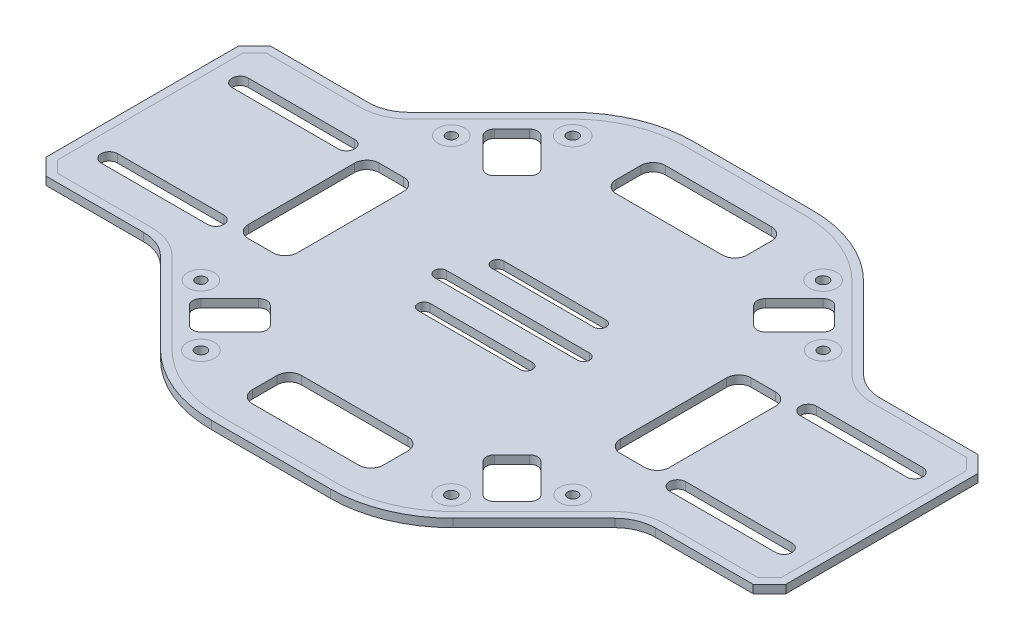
SolidWorks part; units mm, degrees
ref_plane "XY" through (0, 0, 0) normal (0, 0, 1) x (1, 0, 0)
ref_plane "XZ" through (0, 0, 0) normal (0, 1, 0) x (1, 0, 0)
ref_plane "YZ" through (0, 0, 0) normal (1, 0, 0) x (0, 0, -1)
sketch "Esquisse1" plane through (0, 0, 0) normal (0, 1, 0) x (1, 0, 0)
  line L1 (-14.5736, 59) -> (14.5736, 59)
  line L2 (-90.5, 23.5) -> (-90.5, -23.5)
  line L3 (-14.5736, -59) -> (14.5736, -59)
  line L4 (-55.5711, -30.4289) -> (-35.7868, -50.2132)
  line L5 (-90.5, 23.5) -> (-86.5, 27.5)
  line L6 (169.9288, 0) -> (-169.9288, 0) construction
  line L7 (-86.5, 27.5) -> (-62.6421, 27.5)
  line L8 (-55.5711, 30.4289) -> (-35.7868, 50.2132)
  line L9 (0, 72.9784) -> (0, -72.9784) construction
  line L10 (-86.5, -27.5) -> (-62.6421, -27.5)
  line L11 (-90.5, -23.5) -> (-86.5, -27.5)
  line L12 (90.5, -23.5) -> (86.5, -27.5)
  line L13 (86.5, -27.5) -> (62.6421, -27.5)
  line L14 (55.5711, 30.4289) -> (35.7868, 50.2132)
  line L15 (86.5, 27.5) -> (62.6421, 27.5)
  line L16 (90.5, 23.5) -> (86.5, 27.5)
  line L17 (55.5711, -30.4289) -> (35.7868, -50.2132)
  line L18 (90.5, 23.5) -> (90.5, -23.5)
  arc A0 (55.5711, 30.4289) -> (62.6421, 27.5) centre (62.6421, 37.5) ccw
  arc A1 (62.6421, -27.5) -> (55.5711, -30.4289) centre (62.6421, -37.5) ccw
  arc A2 (-55.5711, -30.4289) -> (-62.6421, -27.5) centre (-62.6421, -37.5) ccw
  arc A3 (-62.6421, 27.5) -> (-55.5711, 30.4289) centre (-62.6421, 37.5) ccw
  arc A4 (35.7868, -50.2132) -> (14.5736, -59) centre (14.5736, -29) cw
  arc A5 (-14.5736, -59) -> (-35.7868, -50.2132) centre (-14.5736, -29) cw
  arc A6 (-35.7868, 50.2132) -> (-14.5736, 59) centre (-14.5736, 29) cw
  arc A7 (35.7868, 50.2132) -> (14.5736, 59) centre (14.5736, 29) ccw
  point P3 (58.5, 27.5)
  point P13 (90.5, 0)
  point P14 (0, 59)
  point P18 (-90.5, 0)
  point P27 (0, -59)
  point P30 (58.5, -27.5)
  point P33 (-58.5, -27.5)
  point P36 (-58.5, 27.5)
  point P39 (27, -59)
  point P42 (-27, -59)
  point P45 (-27, 59)
  point P48 (27, 59)
  dimension "D2" = 10
  dimension "D9" = 30
  dimension "D1" = 27
  dimension "D3" = 23.5
  dimension "D4" = 4
  dimension "D5" = 45
  dimension "D6" = 135
  dimension "D7" = 28
  dimension "D8" = 90.5
extrude "brut" add sketch "Esquisse1" against normal blind 2
sketch "Esquisse2" plane through (0, -2, 0) normal (0, -1, 0) x (1, 0, 0)
  line L0 (-17.5, -1.5) -> (17.5, 1.5) construction
  line L1 (-17.5, 1.5) -> (17.5, 1.5)
  line L2 (-12.5, 7.5) -> (12.5, 10.5) construction
  line L3 (-17.5, -1.5) -> (17.5, -1.5)
  line L4 (-12.5, 10.5) -> (12.5, 10.5)
  line L5 (-12.5, 7.5) -> (12.5, 7.5)
  line L6 (-12.5, -10.5) -> (12.5, -7.5) construction
  line L7 (-12.5, -7.5) -> (12.5, -7.5)
  line L8 (-12.5, -10.5) -> (12.5, -10.5)
  line L9 (0, 80.2081) -> (0, -80.2081) construction
  line L10 (-108.4546, 0) -> (108.4546, 0) construction
  line L11 (37.3431, 41.5858) -> (41.5858, 37.3431)
  line L12 (41.5858, 34.5147) -> (34.5147, 27.4437)
  line L13 (-86.5, 27.5) -> (-62.6421, 27.5) construction
  line L14 (-82.5, 18) -> (-56.5, 18)
  line L15 (-90.5, -23.5) -> (-90.5, 23.5) construction
  line L16 (-82.5, 14) -> (-56.5, 14)
  line L17 (-14.5736, 59) -> (14.5736, 59) construction
  line L18 (31.6863, 27.4437) -> (27.4437, 31.6863)
  line L19 (-13, 50.5) -> (13, 50.5)
  line L20 (-56.5, 18) -> (-82.5, 14) construction
  line L21 (-16, 47.5) -> (-16, 41.5)
  line L22 (-13, 38.5) -> (13, 38.5)
  line L23 (16, 47.5) -> (16, 41.5)
  line L24 (16, 50.5) -> (-16, 38.5) construction
  line L25 (56.5, 18) -> (82.5, 18)
  line L26 (56.5, 14) -> (82.5, 14)
  line L27 (82.5, 18) -> (56.5, 14) construction
  line L28 (62.6421, 27.5) -> (86.5, 27.5) construction
  line L29 (90.5, 23.5) -> (90.5, -23.5) construction
  line L30 (0, 0) -> (-55.3356, 55.3356) construction
  line L31 (-41.5858, 37.3431) -> (-37.3431, 41.5858)
  line L32 (-34.5147, 41.5858) -> (-27.4437, 34.5147)
  line L33 (-55.5711, 30.4289) -> (-35.7868, 50.2132) construction
  line L34 (-27.4437, 31.6863) -> (-31.6863, 27.4437)
  line L35 (-34.5147, 27.4437) -> (-41.5858, 34.5147)
  line L36 (-35.9289, 43) -> (-33.1005, 26.0294) construction
  line L37 (0, 0) -> (51.2457, 51.2457) construction
  line L38 (27.4437, 34.5147) -> (34.5147, 41.5858)
  line L39 (43, 35.9289) -> (26.0294, 33.1005) construction
  line L40 (35.7868, 50.2132) -> (55.5711, 30.4289) construction
  line L41 (82.5, -18) -> (56.5, -14) construction
  line L42 (56.5, -14) -> (82.5, -14)
  line L43 (56.5, -18) -> (82.5, -18)
  line L44 (43, -35.9289) -> (26.0294, -33.1005) construction
  line L45 (0, 0) -> (51.2457, -51.2457) construction
  line L46 (27.4437, -34.5147) -> (34.5147, -41.5858)
  line L47 (31.6863, -27.4437) -> (27.4437, -31.6863)
  line L48 (41.5858, -34.5147) -> (34.5147, -27.4437)
  line L49 (37.3431, -41.5858) -> (41.5858, -37.3431)
  line L50 (16, -50.5) -> (-16, -38.5) construction
  line L51 (16, -47.5) -> (16, -41.5)
  line L52 (-13, -38.5) -> (13, -38.5)
  line L53 (-16, -47.5) -> (-16, -41.5)
  line L54 (-13, -50.5) -> (13, -50.5)
  line L55 (-35.9289, -43) -> (-33.1005, -26.0294) construction
  line L56 (-34.5147, -27.4437) -> (-41.5858, -34.5147)
  line L57 (-27.4437, -31.6863) -> (-31.6863, -27.4437)
  line L58 (-34.5147, -41.5858) -> (-27.4437, -34.5147)
  line L59 (-41.5858, -37.3431) -> (-37.3431, -41.5858)
  line L60 (-56.5, -18) -> (-82.5, -14) construction
  line L61 (-82.5, -14) -> (-56.5, -14)
  line L62 (-82.5, -18) -> (-56.5, -18)
  arc A0 (17.5, 1.5) -> (17.5, -1.5) centre (17.5, 0) cw
  arc A1 (-17.5, 1.5) -> (-17.5, -1.5) centre (-17.5, 0) ccw
  arc A2 (12.5, 10.5) -> (12.5, 7.5) centre (12.5, 9) cw
  arc A3 (-12.5, 10.5) -> (-12.5, 7.5) centre (-12.5, 9) ccw
  arc A4 (12.5, -7.5) -> (12.5, -10.5) centre (12.5, -9) cw
  arc A5 (-12.5, -7.5) -> (-12.5, -10.5) centre (-12.5, -9) ccw
  arc A6 (-82.5, 18) -> (-82.5, 14) centre (-82.5, 16) ccw
  arc A7 (-56.5, 18) -> (-56.5, 14) centre (-56.5, 16) cw
  arc A8 (13, 50.5) -> (16, 47.5) centre (13, 47.5) cw
  arc A9 (13, 38.5) -> (16, 41.5) centre (13, 41.5) ccw
  arc A10 (-16, 41.5) -> (-13, 38.5) centre (-13, 41.5) ccw
  arc A11 (-13, 50.5) -> (-16, 47.5) centre (-13, 47.5) ccw
  arc A12 (56.5, 18) -> (56.5, 14) centre (56.5, 16) ccw
  arc A13 (82.5, 18) -> (82.5, 14) centre (82.5, 16) cw
  arc A14 (-27.4437, 34.5147) -> (-27.4437, 31.6863) centre (-28.8579, 33.1005) cw
  arc A15 (-31.6863, 27.4437) -> (-34.5147, 27.4437) centre (-33.1005, 28.8579) cw
  arc A16 (-41.5858, 37.3431) -> (-41.5858, 34.5147) centre (-40.1716, 35.9289) ccw
  arc A17 (-37.3431, 41.5858) -> (-34.5147, 41.5858) centre (-35.9289, 40.1716) cw
  arc A18 (34.5147, 27.4437) -> (31.6863, 27.4437) centre (33.1005, 28.8579) cw
  arc A19 (27.4437, 31.6863) -> (27.4437, 34.5147) centre (28.8579, 33.1005) cw
  arc A20 (37.3431, 41.5858) -> (34.5147, 41.5858) centre (35.9289, 40.1716) ccw
  arc A21 (41.5858, 37.3431) -> (41.5858, 34.5147) centre (40.1716, 35.9289) cw
  arc A22 (37.3431, -41.5858) -> (34.5147, -41.5858) centre (35.9289, -40.1716) cw
  arc A23 (82.5, -18) -> (82.5, -14) centre (82.5, -16) ccw
  arc A24 (56.5, -18) -> (56.5, -14) centre (56.5, -16) cw
  arc A25 (41.5858, -37.3431) -> (41.5858, -34.5147) centre (40.1716, -35.9289) ccw
  arc A26 (27.4437, -31.6863) -> (27.4437, -34.5147) centre (28.8579, -33.1005) ccw
  arc A27 (34.5147, -27.4437) -> (31.6863, -27.4437) centre (33.1005, -28.8579) ccw
  arc A28 (-13, -50.5) -> (-16, -47.5) centre (-13, -47.5) cw
  arc A29 (-16, -41.5) -> (-13, -38.5) centre (-13, -41.5) cw
  arc A30 (13, -38.5) -> (16, -41.5) centre (13, -41.5) cw
  arc A31 (13, -50.5) -> (16, -47.5) centre (13, -47.5) ccw
  arc A32 (-37.3431, -41.5858) -> (-34.5147, -41.5858) centre (-35.9289, -40.1716) ccw
  arc A33 (-41.5858, -37.3431) -> (-41.5858, -34.5147) centre (-40.1716, -35.9289) cw
  arc A34 (-31.6863, -27.4437) -> (-34.5147, -27.4437) centre (-33.1005, -28.8579) ccw
  arc A35 (-27.4437, -34.5147) -> (-27.4437, -31.6863) centre (-28.8579, -33.1005) ccw
  arc A36 (-56.5, -18) -> (-56.5, -14) centre (-56.5, -16) ccw
  arc A37 (-82.5, -18) -> (-82.5, -14) centre (-82.5, -16) cw
  point P19 (0, -9)
  point P20 (0, 9)
  point P41 (-69.5, 16)
  point P42 (0, 44.5)
  point P48 (16, 38.5)
  point P54 (-16, 50.5)
  point P61 (69.5, 16)
  point P74 (-34.5147, 34.5147)
  point P77 (-26.0294, 33.1005)
  point P83 (-43, 35.9289)
  point P92 (34.5147, 34.5147)
  point P114 (69.5, -16)
  point P127 (34.5147, -34.5147)
  point P142 (-16, -50.5)
  point P143 (16, -38.5)
  point P144 (0, -44.5)
  point P159 (-43, -35.9289)
  point P160 (-26.0294, -33.1005)
  point P161 (-34.5147, -34.5147)
  point P168 (-69.5, -16)
  dimension "D5" = 1.5
  dimension "D6" = 6
  dimension "D7" = 3
  dimension "D9" = 1.5
  dimension "D13" = 12.5
  dimension "D16" = 25
  dimension "D20" = 9.5
  dimension "D21" = 2
  dimension "D22" = 2
  dimension "D26" = 12
  dimension "D27" = 8.5
  dimension "D28" = 3
  dimension "D30" = 2
  dimension "D31" = 2
  dimension "D40" = 2
  dimension "D45" = 2
  dimension "D1" = 3
  dimension "D2" = 35
  dimension "D3" = 1.5
  dimension "D4" = 17.5
  dimension "D8" = 25
  dimension "D10" = 6
  dimension "D11" = 12.5
  dimension "D12" = 3
  dimension "D14" = 1.5
  dimension "D15" = 1.5
  dimension "D17" = 1.5
  dimension "D18" = 4
  dimension "D19" = 8
  dimension "D23" = 26
  dimension "D24" = 26
  dimension "D25" = 32
  dimension "D29" = 4
  dimension "D32" = 26
  dimension "D33" = 26
  dimension "D34" = 9.5
  dimension "D35" = 8
  dimension "D36" = 45
  dimension "D37" = 5
  dimension "D38" = 10
  dimension "D39" = 14
  dimension "D41" = 45
  dimension "D42" = 5
  dimension "D43" = 10
  dimension "D44" = 6
extrude "encoches" cut sketch "Esquisse2" against normal through all
sketch "Esquisse3" plane through (0, -2, 0) normal (0, -1, 0) x (1, 0, 0)
  line L0 (0, 66.1982) -> (0, -64.8258) construction
  line L1 (-96.2384, 0) -> (93.8355, 0) construction
  line L2 (-51.5, 16) -> (-39.5, -16) construction
  line L3 (-48.5, 16) -> (-42.5, 16)
  line L4 (-51.5, 13) -> (-51.5, -13)
  line L5 (-48.5, -16) -> (-42.5, -16)
  line L6 (-39.5, 13) -> (-39.5, -13)
  line L7 (-90.5, -23.5) -> (-90.5, 23.5) construction
  line L8 (51.5, 16) -> (39.5, -16) construction
  line L9 (39.5, 13) -> (39.5, -13)
  line L10 (48.5, -16) -> (42.5, -16)
  line L11 (51.5, 13) -> (51.5, -13)
  line L12 (48.5, 16) -> (42.5, 16)
  arc A0 (-51.5, -13) -> (-48.5, -16) centre (-48.5, -13) ccw
  arc A1 (-42.5, -16) -> (-39.5, -13) centre (-42.5, -13) ccw
  arc A2 (-42.5, 16) -> (-39.5, 13) centre (-42.5, 13) cw
  arc A3 (-48.5, 16) -> (-51.5, 13) centre (-48.5, 13) ccw
  arc A4 (48.5, 16) -> (51.5, 13) centre (48.5, 13) cw
  arc A5 (42.5, 16) -> (39.5, 13) centre (42.5, 13) ccw
  arc A6 (42.5, -16) -> (39.5, -13) centre (42.5, -13) cw
  arc A7 (51.5, -13) -> (48.5, -16) centre (48.5, -13) cw
  point P9 (-45.5, 0)
  point P19 (-39.5, 16)
  point P37 (39.5, 16)
  point P38 (45.5, 0)
  dimension "D4" = 3
  dimension "D1" = 12
  dimension "D2" = 32
  dimension "D3" = 39
extrude "encoches 2" cut sketch "Esquisse3" against normal through all
sketch "Esquisse4" plane through (0, -2, 0) normal (0, -1, 0) x (1, 0, 0)
  line L0 (-93.7141, 0) -> (92.9596, 0) construction
  line L1 (0, 64.9786) -> (0, -61.9681) construction
  line L2 (0, 0) -> (-50.0343, 50.0343) construction
  line L3 (-55.5711, 30.4289) -> (-35.7868, 50.2132) construction
  line L4 (0, 0) -> (50.0343, 50.0343) construction
  circle A0 centre (-30.6256, 45.4749) radius 1.35
  circle A1 centre (-45.4749, 30.6256) radius 1.25
  circle A2 centre (45.4749, 30.6256) radius 1.25
  circle A3 centre (30.6256, 45.4749) radius 1.35
  circle A4 centre (30.6256, -45.4749) radius 1.35
  circle A5 centre (45.4749, -30.6256) radius 1.25
  circle A6 centre (-45.4749, -30.6256) radius 1.25
  circle A7 centre (-30.6256, -45.4749) radius 1.35
  dimension "D1" = 2.5
  dimension "D2" = 2.7
  dimension "D3" = 21
  dimension "D4" = 45
  dimension "D5" = 10.5
  dimension "D6" = 7
  dimension "D7" = 7
extrude "passage de vis" cut sketch "Esquisse4" against normal through all
sketch "Esquisse5" plane through (0, -2, 0) normal (0, -1, 0) x (1, 0, 0)
  line L238 (-34.3726, 48.799) -> (-54.1569, 29.0147)
  line L239 (-62.6421, 25.5) -> (-85.6716, 25.5)
  line L240 (-85.6716, 25.5) -> (-88.5, 22.6716)
  line L241 (-88.5, 22.6716) -> (-88.5, -22.6716)
  line L242 (-88.5, -22.6716) -> (-85.6716, -25.5)
  line L243 (-85.6716, -25.5) -> (-62.6421, -25.5)
  line L244 (-54.1569, -29.0147) -> (-34.3726, -48.799)
  line L245 (-14.5736, -57) -> (14.5736, -57)
  line L246 (34.3726, -48.799) -> (54.1569, -29.0147)
  line L247 (62.6421, -25.5) -> (85.6716, -25.5)
  line L248 (85.6716, -25.5) -> (88.5, -22.6716)
  line L249 (88.5, -22.6716) -> (88.5, 22.6716)
  line L250 (88.5, 22.6716) -> (85.6716, 25.5)
  line L251 (85.6716, 25.5) -> (62.6421, 25.5)
  line L252 (54.1569, 29.0147) -> (34.3726, 48.799)
  line L253 (14.5736, 57) -> (-14.5736, 57)
  line L254 (-34.3726, 48.799) -> (-54.1569, 29.0147)
  line L255 (-62.6421, 25.5) -> (-85.6716, 25.5)
  line L256 (-85.6716, 25.5) -> (-88.5, 22.6716)
  line L257 (-88.5, 22.6716) -> (-88.5, -22.6716)
  line L258 (-88.5, -22.6716) -> (-85.6716, -25.5)
  line L259 (-85.6716, -25.5) -> (-62.6421, -25.5)
  line L260 (-54.1569, -29.0147) -> (-34.3726, -48.799)
  line L261 (-14.5736, -57) -> (14.5736, -57)
  line L262 (34.3726, -48.799) -> (54.1569, -29.0147)
  line L263 (62.6421, -25.5) -> (85.6716, -25.5)
  line L264 (85.6716, -25.5) -> (88.5, -22.6716)
  line L265 (88.5, -22.6716) -> (88.5, 22.6716)
  line L266 (88.5, 22.6716) -> (85.6716, 25.5)
  line L267 (85.6716, 25.5) -> (62.6421, 25.5)
  line L268 (54.1569, 29.0147) -> (34.3726, 48.799)
  line L269 (14.5736, 57) -> (-14.5736, 57)
  circle A129 centre (-45.4749, 30.6256) radius 3.25
  circle A130 centre (-45.4749, 30.6256) radius 3.25
  circle A132 centre (-30.6256, 45.4749) radius 3.35
  circle A133 centre (-30.6256, 45.4749) radius 3.35
  arc A135 (-62.6421, 25.5) -> (-54.1569, 29.0147) centre (-62.6421, 37.5) ccw
  arc A136 (-54.1569, -29.0147) -> (-62.6421, -25.5) centre (-62.6421, -37.5) ccw
  arc A137 (-34.3726, -48.799) -> (-14.5736, -57) centre (-14.5736, -29) ccw
  arc A138 (14.5736, -57) -> (34.3726, -48.799) centre (14.5736, -29) ccw
  arc A139 (62.6421, -25.5) -> (54.1569, -29.0147) centre (62.6421, -37.5) ccw
  arc A140 (54.1569, 29.0147) -> (62.6421, 25.5) centre (62.6421, 37.5) ccw
  arc A141 (34.3726, 48.799) -> (14.5736, 57) centre (14.5736, 29) ccw
  arc A142 (-14.5736, 57) -> (-34.3726, 48.799) centre (-14.5736, 29) ccw
  arc A143 (-62.6421, 25.5) -> (-54.1569, 29.0147) centre (-62.6421, 37.5) ccw
  arc A144 (-54.1569, -29.0147) -> (-62.6421, -25.5) centre (-62.6421, -37.5) ccw
  arc A145 (-34.3726, -48.799) -> (-14.5736, -57) centre (-14.5736, -29) ccw
  arc A146 (14.5736, -57) -> (34.3726, -48.799) centre (14.5736, -29) ccw
  arc A147 (62.6421, -25.5) -> (54.1569, -29.0147) centre (62.6421, -37.5) ccw
  arc A148 (54.1569, 29.0147) -> (62.6421, 25.5) centre (62.6421, 37.5) ccw
  arc A149 (34.3726, 48.799) -> (14.5736, 57) centre (14.5736, 29) ccw
  arc A150 (-14.5736, 57) -> (-34.3726, 48.799) centre (-14.5736, 29) ccw
  circle A151 centre (30.6256, 45.4749) radius 3.35
  circle A152 centre (30.6256, 45.4749) radius 3.35
  circle A161 centre (45.4749, -30.6256) radius 3.25
  circle A162 centre (45.4749, -30.6256) radius 3.25
  circle A164 centre (45.4749, 30.6256) radius 3.25
  circle A165 centre (45.4749, 30.6256) radius 3.25
  circle A167 centre (30.6256, -45.4749) radius 3.35
  circle A168 centre (30.6256, -45.4749) radius 3.35
  circle A170 centre (-30.6256, -45.4749) radius 3.35
  circle A171 centre (-30.6256, -45.4749) radius 3.35
  circle A173 centre (-45.4749, -30.6256) radius 3.25
  circle A174 centre (-45.4749, -30.6256) radius 3.25
  dimension "D1" = 2
  dimension "D2" = 2
  dimension "D3" = 2
  dimension "D4" = 2
  dimension "D5" = 2
  dimension "D6" = 2
  dimension "D7" = 2
  dimension "D8" = 2
  dimension "D9" = 2
sketch "Esquisse6" plane through (0, 0, 0) normal (0, 1, 0) x (1, 0, 0)
  line L16 (-54.1569, -29.0147) -> (-34.3726, -48.799)
  line L17 (-85.6716, -25.5) -> (-62.6421, -25.5)
  line L18 (-88.5, -22.6716) -> (-85.6716, -25.5)
  line L19 (-88.5, 22.6716) -> (-88.5, -22.6716)
  line L20 (-85.6716, 25.5) -> (-88.5, 22.6716)
  line L21 (-62.6421, 25.5) -> (-85.6716, 25.5)
  line L22 (-34.3726, 48.799) -> (-54.1569, 29.0147)
  line L23 (14.5736, 57) -> (-14.5736, 57)
  line L24 (54.1569, 29.0147) -> (34.3726, 48.799)
  line L25 (85.6716, 25.5) -> (62.6421, 25.5)
  line L26 (88.5, 22.6716) -> (85.6716, 25.5)
  line L27 (88.5, -22.6716) -> (88.5, 22.6716)
  line L28 (85.6716, -25.5) -> (88.5, -22.6716)
  line L29 (62.6421, -25.5) -> (85.6716, -25.5)
  line L30 (34.3726, -48.799) -> (54.1569, -29.0147)
  line L31 (-14.5736, -57) -> (14.5736, -57)
  line L32 (-54.1569, -29.0147) -> (-34.3726, -48.799)
  line L33 (-85.6716, -25.5) -> (-62.6421, -25.5)
  line L34 (-88.5, -22.6716) -> (-85.6716, -25.5)
  line L35 (-88.5, 22.6716) -> (-88.5, -22.6716)
  line L36 (-85.6716, 25.5) -> (-88.5, 22.6716)
  line L37 (-62.6421, 25.5) -> (-85.6716, 25.5)
  line L38 (-34.3726, 48.799) -> (-54.1569, 29.0147)
  line L39 (14.5736, 57) -> (-14.5736, 57)
  line L40 (54.1569, 29.0147) -> (34.3726, 48.799)
  line L41 (85.6716, 25.5) -> (62.6421, 25.5)
  line L42 (88.5, 22.6716) -> (85.6716, 25.5)
  line L43 (88.5, -22.6716) -> (88.5, 22.6716)
  line L44 (85.6716, -25.5) -> (88.5, -22.6716)
  line L45 (62.6421, -25.5) -> (85.6716, -25.5)
  line L46 (34.3726, -48.799) -> (54.1569, -29.0147)
  line L47 (-14.5736, -57) -> (14.5736, -57)
  circle A1 centre (45.4749, -30.6256) radius 3.25
  circle A2 centre (45.4749, -30.6256) radius 3.25
  circle A3 centre (30.6256, -45.4749) radius 3.35
  circle A4 centre (30.6256, -45.4749) radius 3.35
  circle A5 centre (-30.6256, -45.4749) radius 3.35
  circle A6 centre (-30.6256, -45.4749) radius 3.35
  circle A7 centre (-45.4749, -30.6256) radius 3.25
  circle A8 centre (-45.4749, -30.6256) radius 3.25
  circle A9 centre (-45.4749, 30.6256) radius 3.25
  circle A10 centre (-45.4749, 30.6256) radius 3.25
  circle A11 centre (-30.6256, 45.4749) radius 3.35
  circle A12 centre (-30.6256, 45.4749) radius 3.35
  circle A13 centre (30.6256, 45.4749) radius 3.35
  circle A14 centre (30.6256, 45.4749) radius 3.35
  circle A15 centre (45.4749, 30.6256) radius 3.25
  circle A16 centre (45.4749, 30.6256) radius 3.25
  arc A24 (-34.3726, -48.799) -> (-14.5736, -57) centre (-14.5736, -29) ccw
  arc A25 (-54.1569, -29.0147) -> (-62.6421, -25.5) centre (-62.6421, -37.5) ccw
  arc A26 (-62.6421, 25.5) -> (-54.1569, 29.0147) centre (-62.6421, 37.5) ccw
  arc A27 (-14.5736, 57) -> (-34.3726, 48.799) centre (-14.5736, 29) ccw
  arc A28 (34.3726, 48.799) -> (14.5736, 57) centre (14.5736, 29) ccw
  arc A29 (54.1569, 29.0147) -> (62.6421, 25.5) centre (62.6421, 37.5) ccw
  arc A30 (62.6421, -25.5) -> (54.1569, -29.0147) centre (62.6421, -37.5) ccw
  arc A31 (14.5736, -57) -> (34.3726, -48.799) centre (14.5736, -29) ccw
  arc A32 (-34.3726, -48.799) -> (-14.5736, -57) centre (-14.5736, -29) ccw
  arc A33 (-54.1569, -29.0147) -> (-62.6421, -25.5) centre (-62.6421, -37.5) ccw
  arc A34 (-62.6421, 25.5) -> (-54.1569, 29.0147) centre (-62.6421, 37.5) ccw
  arc A35 (-14.5736, 57) -> (-34.3726, 48.799) centre (-14.5736, 29) ccw
  arc A36 (34.3726, 48.799) -> (14.5736, 57) centre (14.5736, 29) ccw
  arc A37 (54.1569, 29.0147) -> (62.6421, 25.5) centre (62.6421, 37.5) ccw
  arc A38 (62.6421, -25.5) -> (54.1569, -29.0147) centre (62.6421, -37.5) ccw
  arc A39 (14.5736, -57) -> (34.3726, -48.799) centre (14.5736, -29) ccw
  dimension "D1" = 0
  dimension "D2" = 0
  dimension "D3" = 0
  dimension "D4" = 0
  dimension "D5" = 0
  dimension "D6" = 0
  dimension "D7" = 0
  dimension "D8" = 0
  dimension "D9" = 0
